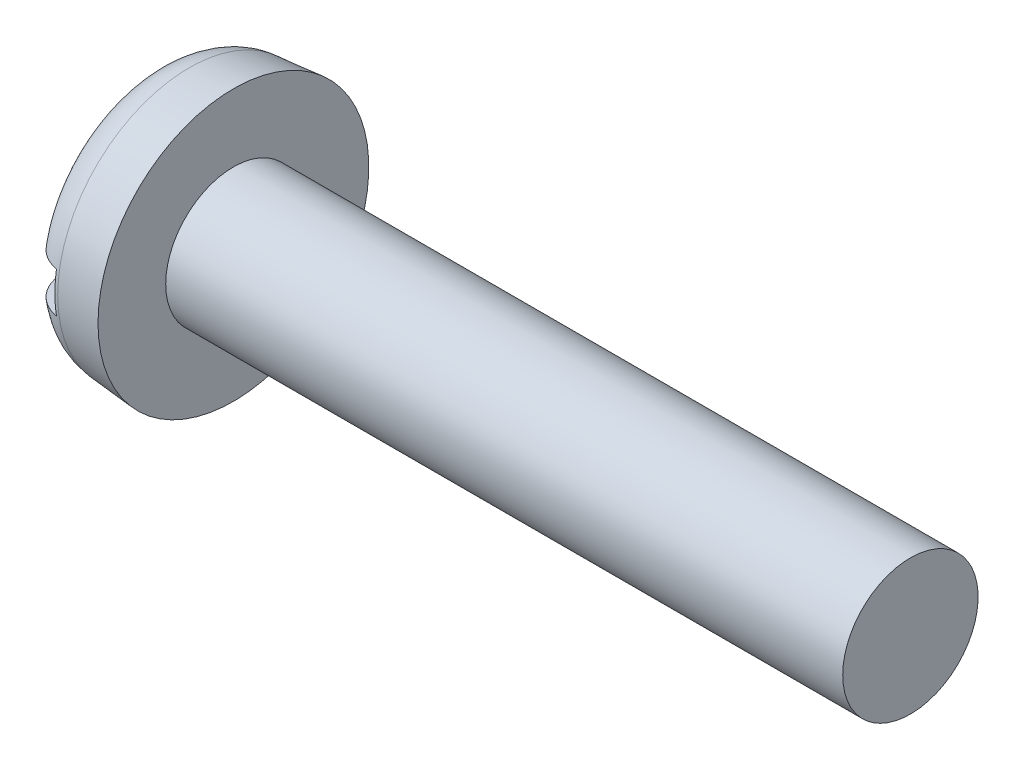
SolidWorks part; units mm, degrees
ref_plane "Plane1" through (0, 0, 0) normal (0, 0, 1) x (1, 0, 0)
ref_plane "Plane2" through (0, 0, 0) normal (0, 1, 0) x (1, 0, 0)
ref_plane "Plane3" through (0, 0, 0) normal (1, 0, 0) x (0, 0, -1)
sketch "BodySke" plane through (0, 0, 0) normal (0, 0, 1) x (1, 0, 0)
  line L0 (2.4, 2) -> (2.4, 4)
  line L1 (0, 0) -> (0, 3.79)
  line L2 (-25.4, 0) -> (127, 0) construction
  line L3 (22.4, 0) -> (0, 0)
  line L4 (2.4, 2) -> (22.4, 2)
  line L5 (22.4, 2) -> (22.4, 0)
  line L6 (0, 3.79) -> (2.4, 4)
  line L9 (3.1, 3.5875) -> (3.1, -5.9375) construction
  line L10 (2.4, 6.35) -> (2.4, -3.175) construction
  dimension "Head_ht" = 2.4
  dimension "Diameter" = 4
  dimension "Length" = 20
  dimension "Head_dia" = 8
  dimension "Advance" = 0.7
  dimension "Thread_nom" = 20
  dimension "Head_side_angle" = 5
revolve "Base-Revolve" add sketch "BodySke"
fillet "Fillet1" [suppressed] radius 0.2
fillet "Fillet2" radius 1.2 1 edges at (0, 0, 3.79)
sketch "Sketch2" plane through (0, 0, 0) normal (1, 0, 0) x (0, 0, -1)
  line L0 (4, -0.6) -> (-4, -0.6)
  line L1 (4, -0.6) -> (4, 0.6)
  line L2 (-4, 0.6) -> (4, 0.6)
  line L3 (-4, 0.6) -> (-4, -0.6)
  dimension "D1" = 8
  dimension "D2" = 4
  dimension "Slot_width" = 1.2
  dimension "D3" = 0.6
extrude "Slot" cut sketch "Sketch2" along normal blind 1
sketch "ThdSchSke" plane through (0, 0, 0) normal (0, 0, 1) x (1, 0, 0)
  line L0 (3.8, -1.61) -> (3.5269, -2)
  line L1 (3.8, -1.61) -> (4.0731, -2)
  line L2 (4.0731, -2) -> (4.0731, -2.5)
  line L3 (-3.175, 0) -> (5.1513, 0) construction
  line L5 (4.0731, -2.5) -> (3.5269, -2.5)
  line L6 (3.5269, -2.5) -> (3.5269, -2)
  dimension "Thread_minor" = 3.22
  dimension "Diameter" = 4
  dimension "Start" = 3.8
  dimension "SideAngle" = 55
  dimension "VeeAngle" = 70
  dimension "Overcut" = 5
revolve "ThreadSchematic" [suppressed] cut sketch "ThdSchSke" angle 360 about L3
pattern_linear "ThdSchPat" [suppressed]
equation "\"D1@Sketch2\" = \"Head_dia@BodySke\""
equation "\"D2@Sketch2\" = \"D1@Sketch2\" / 2"
equation "\"D3@Sketch2\" = \"Slot_width@Sketch2\" / 2"
equation "\"Thread_length@ThreadCosmetic\" = ((sgn( (\"Length@BodySke\" - \"Advance@BodySke\" * 2.0 ) - \"Thread_nom@BodySke\" )-1)*( (\"Length@BodySke\" - \"Advance@BodySke\"  * 2.0) - \"Thread_nom@BodySke\" ))/-2+ \"Thread_"
equation "\"Thread_minor@ThdSchSke\" = \"Thread_minor@ThreadCosmetic\""
equation "\"Diameter@ThdSchSke\" = \"Diameter@BodySke\""
equation "\"Overcut@ThdSchSke\" = \"Diameter@BodySke\" * 1.25"
equation "\"Start@ThdSchSke\" = \"Head_ht@BodySke\" + \"Length@BodySke\" - \"Thread_length@ThreadCosmetic\"  '---Non-countersunk---"
equation "\"Num_threads@ThdSchPat\" = int( \"Thread_length@ThreadCosmetic\" / \"Advance@BodySke\" + 0.999 )  + 1"
equation "\"Advance@ThdSchPat\" = \"Thread_length@ThreadCosmetic\" /  (\"Num_threads@ThdSchPat\" - 1) 'relax it"
